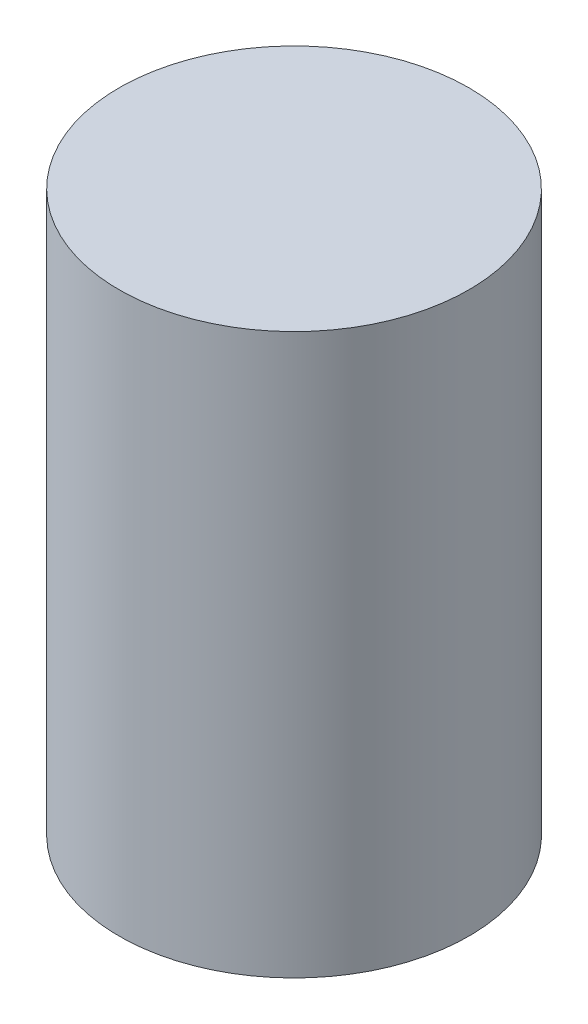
SolidWorks part; units mm, degrees
ref_plane "正面" through (0, 0, 0) normal (0, 0, 1) x (1, 0, 0)
ref_plane "平面" through (0, 0, 0) normal (0, 1, 0) x (1, 0, 0)
ref_plane "右側面" through (0, 0, 0) normal (1, 0, 0) x (0, 0, -1)
sketch "ｽｹｯﾁ1" plane through (0, 0, 0) normal (0, 0, 1) x (1, 0, 0)
  line L0 (0, 0) -> (0, 109.9886) construction
  line L2 (0, 0) -> (25, 0)
  line L3 (0, 0) -> (0, 80)
  line L4 (0, 80) -> (25, 80)
  line L5 (25, 0) -> (25, 80)
  dimension "D1" = 50
  dimension "D2" = 80
revolve "回転1" add sketch "ｽｹｯﾁ1" angle 360 about L0
